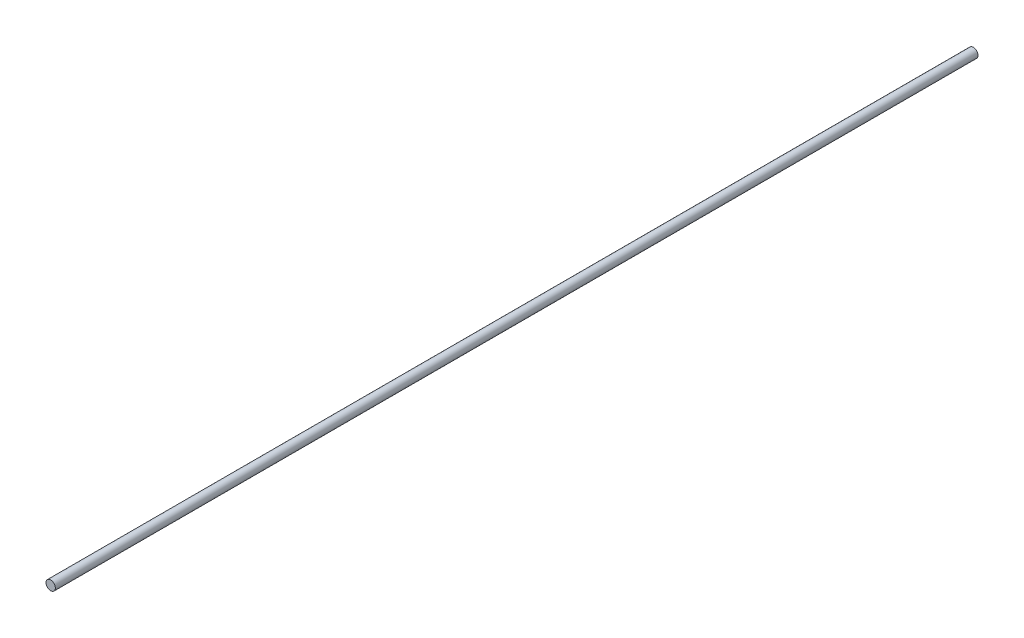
SolidWorks part; units mm, degrees
ref_plane "Front Plane" through (0, 0, 0) normal (0, 0, 1) x (1, 0, 0)
ref_plane "Top Plane" through (0, 0, 0) normal (0, 1, 0) x (1, 0, 0)
ref_plane "Right Plane" through (0, 0, 0) normal (1, 0, 0) x (0, 0, -1)
sketch "Sketch1" plane through (0, 0, 0) normal (0, 0, 1) x (1, 0, 0)
  circle A0 centre (0, 0) radius 30
  dimension "D1" = 60
extrude "Boss-Extrude1" add sketch "Sketch1" against normal blind 5900
